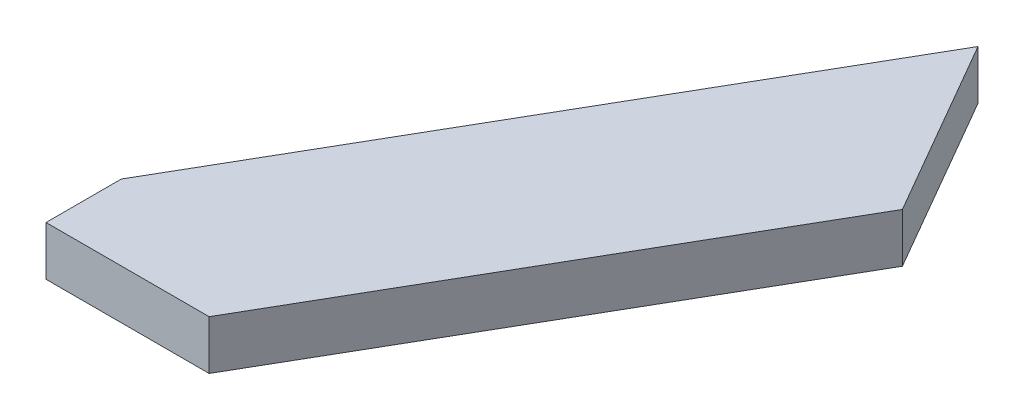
SolidWorks part; units mm, degrees
ref_plane "Front Plane" through (0, 0, 0) normal (1, 0, 0) x (0, 1, 0)
ref_plane "Top Plane" through (0, 0, 0) normal (0, 0, 1) x (0, 1, 0)
ref_plane "Right Plane" through (0, 0, 0) normal (0, 1, 0) x (-1, 0, 0)
sketch "sk w193" plane through (0, 0, 0) normal (0, 0, 1) x (0, 1, 0)
  point P0 (-399.034, -196.596)
  point P3 (-188.214, 0)
  line B0 (-399.034, -196.596) -> (-399.034, -160.02)
  line B1 (-399.034, -160.02) -> (-226.06, -160.02)
  line B2 (-210.82, -144.78) -> (-210.82, 144.78)
  line B3 (-226.06, 160.02) -> (-399.034, 160.02)
  line B4 (-399.034, 160.02) -> (-399.034, 196.596)
  line B5 (-399.034, 196.596) -> (0, 196.596)
  line B6 (0, 196.596) -> (0, 160.02)
  line B7 (0, 160.02) -> (-172.974, 160.02)
  line B8 (-188.214, 144.78) -> (-188.214, -144.78)
  line B9 (-172.974, -160.02) -> (0, -160.02)
  line B10 (0, -160.02) -> (0, -196.596)
  line B11 (0, -196.596) -> (-399.034, -196.596)
  arc B12 (-226.06, -160.02) -> (-210.82, -144.78) centre (-226.06, -144.78) ccw
  arc B13 (-210.82, 144.78) -> (-226.06, 160.02) centre (-226.06, 144.78) ccw
  arc B14 (-172.974, 160.02) -> (-188.214, 144.78) centre (-172.974, 144.78) ccw
  arc B15 (-188.214, -144.78) -> (-172.974, -160.02) centre (-172.974, -144.78) ccw
sketch_block_instance "w14x193-1-1"
sketch_block "w14x193-1" parameters "D4"=15.24, "D1"=399.034, "D2"=393.192, "D3"=22.606, "D5"=36.576
sketch "Sketch2" plane through (0, 0, 0) normal (0, 0, 1) x (0, 1, 0)
  line L0 (320, 501.4782) -> (320, -809.7231)
  line L1 (-188.214, 144.78) -> (-188.214, -144.78)
  line L2 (-188.214, -144.78) -> (-172.974, -160.02)
  line L3 (-172.974, -160.02) -> (5, -160.02)
  line L4 (-188.214, 144.78) -> (-172.974, 160.02)
  line L5 (-172.974, 160.02) -> (5, 160.02)
  line L6 (5, 201.596) -> (5, 160.02)
  line L7 (0, 196.596) -> (0, 160.02) construction
  line L8 (5, -160.02) -> (5, -201.596)
  line L9 (-285.82, 201.596) -> (5, 201.596)
  line L10 (-285.82, -201.596) -> (5, -201.596)
  line L11 (-285.82, 201.596) -> (-285.82, 239.696)
  line L12 (-285.82, 239.696) -> (167.6, 501.4782)
  line L13 (-285.82, -201.596) -> (-285.82, -239.696)
  line L14 (-285.82, -239.696) -> (167.6, -809.7231)
  line L15 (-210.82, -144.78) -> (-210.82, 144.78) construction
  line L16 (-399.034, 196.596) -> (0, 196.596) construction
  line L17 (0, -196.596) -> (-399.034, -196.596) construction
  line L18 (320, 501.4782) -> (167.6, 501.4782)
  line L19 (320, -809.7231) -> (167.6, -809.7231)
  point P30 (320, 501.4782)
  point P31 (320, -809.7231)
  dimension "D1" = 320
  dimension "D2" = 5
  dimension "D3" = 75
  dimension "D4" = 5
  dimension "D5" = 5
  dimension "D6" = 30
  dimension "D7" = 51.5
  dimension "D8" = 38.1
  dimension "D9" = 38.1
  dimension "D10" = 152.4
sketch "Sketch3" plane through (0, 0, 0) normal (0, 1, 0) x (-1, 0, 0)
  line L5 (39.2933, 195.058) -> (155.1123, 195.058)
  line L10 (155.1123, 195.058) -> (155.1123, 141.6623)
  line L11 (155.1123, 141.6623) -> (-67.5086, -243.9284)
  line L14 (39.2933, 195.058) -> (-140.8321, -116.9284)
  line L15 (-47.2856, 45.0989) -> (47.2856, -45.0989) construction
  line L18 (-67.5086, -243.9284) -> (-140.8321, -116.9284)
  line L23 (32.3257, 207.1262) -> (-147.7997, -104.8602) construction
  line L24 (167.1805, 138.4287) -> (-60.541, -255.9966) construction
  line L25 (32.3257, 207.1262) -> (167.1805, 207.1262) construction
  line L26 (167.1805, 207.1262) -> (167.1805, 138.4287) construction
  line L27 (-60.541, -231.8602) -> (-133.8645, -104.8602) construction
  line L28 (39.2933, 195.058) -> (-133.8645, -104.8602) construction
  line L29 (155.1123, 141.6623) -> (-60.541, -231.8602) construction
  line L30 (-60.541, -255.9966) -> (-147.7997, -104.8602) construction
  point P8 (0, 0)
  dimension "D1" = 360.2508
  dimension "D2" = 127
  dimension "D3" = 115.819
  dimension "D5" = 445.2418
  dimension "D6" = 60
extrude "Boss-Extrude1" add sketch "Sketch3" along normal mid plane 34.925
